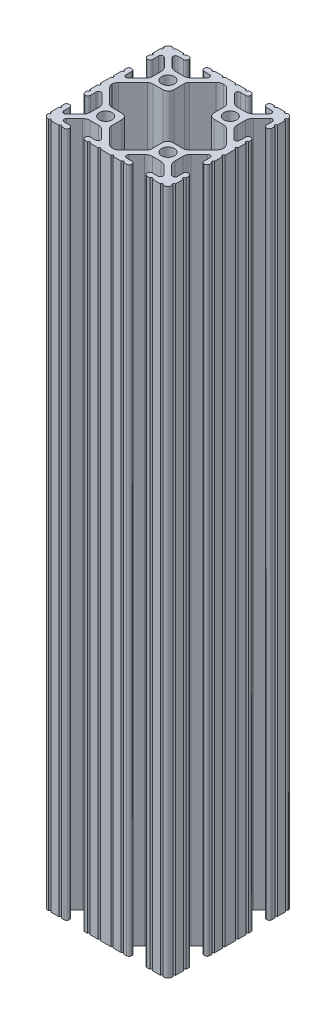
SolidWorks part; units mm, degrees
ref_plane "Front Plane" through (0, 0, 0) normal (0, 0, 1) x (1, 0, 0)
ref_plane "Top Plane" through (0, 0, 0) normal (0, 1, 0) x (1, 0, 0)
ref_plane "Right Plane" through (0, 0, 0) normal (1, 0, 0) x (0, 0, -1)
sketch "Sketch1" plane through (0, 0, 0) normal (0, 1, 0) x (0, 0, -1)
  line L0 (-7.684, -16.0797) -> (-1.9878, -21.7759)
  line L1 (-8.3312, -10.3886) -> (-8.3312, -14.5171)
  line L2 (-14.8165, -8.1788) -> (-10.541, -8.1788)
  line L3 (-21.7734, -2.1502) -> (-16.3772, -7.5334)
  line L4 (-22.6314, 0.0822) -> (-22.6314, -0.0822)
  line L5 (-16.3772, 7.5334) -> (-21.7734, 2.1502)
  line L6 (-10.541, 8.1788) -> (-14.8165, 8.1788)
  line L7 (-8.3312, 14.5171) -> (-8.3312, 10.3886)
  line L8 (-1.7956, 21.9681) -> (-7.684, 16.0797)
  line L9 (7.684, 16.0797) -> (1.7956, 21.9681)
  line L10 (8.3312, 10.389) -> (8.3312, 14.5171)
  line L11 (14.8161, 8.1792) -> (10.541, 8.1792)
  line L12 (21.7734, 2.1502) -> (16.3768, 7.5339)
  line L13 (22.6314, -0.0822) -> (22.6314, 0.0822)
  line L14 (16.3772, -7.5334) -> (21.7734, -2.1502)
  line L15 (10.541, -8.1788) -> (14.8165, -8.1788)
  line L16 (8.3312, -14.5171) -> (8.3312, -10.3886)
  line L17 (1.9878, -21.7759) -> (7.684, -16.0797)
  line L18 (7.4579, -25.3998) -> (8.4051, -25.3998)
  line L19 (9.4615, -24.3585) -> (9.4615, -24.2315)
  line L20 (8.4051, -23.1902) -> (6.0878, -23.1902)
  line L21 (5.388, -21.5008) -> (8.763, -18.1257)
  line L22 (11.0081, -17.1958) -> (14.3919, -17.1958)
  line L23 (16.637, -18.1257) -> (20.012, -21.5008)
  line L24 (19.2977, -23.1901) -> (16.9799, -23.1901)
  line L25 (15.9385, -24.2315) -> (15.9385, -24.3585)
  line L26 (16.9949, -25.3998) -> (18.134, -25.3998)
  line L27 (19.1384, -25.3998) -> (22.4132, -25.3998)
  line L28 (23.4176, -25.3998) -> (23.4501, -25.3998)
  line L29 (25.4, -23.2975) -> (25.4, -23.2686)
  line L30 (25.4, -22.2526) -> (25.4, -19.0252)
  line L31 (25.4, -18.0092) -> (25.4, -16.916)
  line L32 (24.3586, -15.8746) -> (24.2316, -15.8746)
  line L33 (23.1902, -16.916) -> (23.1902, -19.101)
  line L34 (21.4558, -19.8194) -> (18.2781, -16.6418)
  line L35 (17.3482, -14.3967) -> (17.3482, -11.0035)
  line L36 (18.2808, -8.7557) -> (21.4566, -5.5875)
  line L37 (23.1902, -6.3068) -> (23.1902, -8.484)
  line L38 (24.2316, -9.5254) -> (24.3586, -9.5254)
  line L39 (25.4, -8.484) -> (25.4, -7.3277)
  line L40 (25.4, -6.3117) -> (25.4, -3.0843)
  line L41 (25.4, -2.0683) -> (25.4, 2.0683)
  line L42 (25.4, 3.0843) -> (25.4, 6.3117)
  line L43 (25.4, 7.3277) -> (25.4, 8.484)
  line L44 (24.3586, 9.5254) -> (24.2316, 9.5254)
  line L45 (23.1902, 8.484) -> (23.1902, 6.3068)
  line L46 (21.4566, 5.5875) -> (18.2808, 8.7557)
  line L47 (17.3482, 11.0035) -> (17.3482, 14.3967)
  line L48 (18.2781, 16.6418) -> (21.4558, 19.8194)
  line L49 (23.1902, 19.101) -> (23.1902, 16.916)
  line L50 (24.2316, 15.8746) -> (24.3586, 15.8746)
  line L51 (25.4, 16.916) -> (25.4, 18.0092)
  line L52 (25.4, 19.0252) -> (25.4, 22.2526)
  line L53 (25.4, 23.2686) -> (25.4, 23.2975)
  line L54 (23.4501, 25.3998) -> (23.4176, 25.3998)
  line L55 (22.4132, 25.3998) -> (19.1384, 25.3998)
  line L56 (18.134, 25.3998) -> (16.9949, 25.3998)
  line L57 (15.9385, 24.3585) -> (15.9385, 24.2315)
  line L58 (16.9799, 23.1901) -> (19.2977, 23.1901)
  line L59 (20.012, 21.5008) -> (16.637, 18.1257)
  line L60 (14.3919, 17.1958) -> (11.0081, 17.1958)
  line L61 (8.763, 18.1257) -> (5.388, 21.5008)
  line L62 (6.0878, 23.1902) -> (8.4051, 23.1902)
  line L63 (9.4615, 24.2315) -> (9.4615, 24.3585)
  line L64 (8.4051, 25.3998) -> (7.4579, 25.3998)
  line L65 (6.4535, 25.3998) -> (3.2145, 25.3998)
  line L66 (2.2101, 25.3998) -> (-2.2101, 25.3998)
  line L67 (-3.2145, 25.3998) -> (-6.4535, 25.3998)
  line L68 (-7.4579, 25.3998) -> (-8.4051, 25.3998)
  line L69 (-9.4615, 24.3585) -> (-9.4615, 24.2315)
  line L70 (-8.4051, 23.1902) -> (-6.0878, 23.1902)
  line L71 (-5.388, 21.5008) -> (-8.763, 18.1257)
  line L72 (-11.0081, 17.1958) -> (-14.3919, 17.1958)
  line L73 (-16.637, 18.1257) -> (-20.012, 21.5008)
  line L74 (-19.2977, 23.1901) -> (-16.9799, 23.1901)
  line L75 (-15.9385, 24.2315) -> (-15.9385, 24.3585)
  line L76 (-16.9949, 25.3998) -> (-18.134, 25.3998)
  line L77 (-19.1384, 25.3998) -> (-22.4132, 25.3998)
  line L78 (-23.4176, 25.3998) -> (-23.4501, 25.3998)
  line L79 (-25.4, 23.2975) -> (-25.4, 23.2686)
  line L80 (-25.4, 22.2526) -> (-25.4, 19.0252)
  line L81 (-25.4, 18.0092) -> (-25.4, 16.916)
  line L82 (-24.3586, 15.8746) -> (-24.2316, 15.8746)
  line L83 (-23.1902, 16.916) -> (-23.1902, 19.101)
  line L84 (-21.4558, 19.8194) -> (-18.2781, 16.6418)
  line L85 (-17.3482, 14.3967) -> (-17.3482, 11.0035)
  line L86 (-18.2808, 8.7557) -> (-21.4566, 5.5875)
  line L87 (-23.1902, 6.3068) -> (-23.1902, 8.484)
  line L88 (-24.2316, 9.5254) -> (-24.3586, 9.5254)
  line L89 (-25.4, 8.484) -> (-25.4, 7.3277)
  line L90 (-25.4, 6.3117) -> (-25.4, 3.0843)
  line L91 (-25.4, 2.0683) -> (-25.4, -2.0683)
  line L92 (-25.4, -3.0843) -> (-25.4, -6.3117)
  line L93 (-25.4, -7.3277) -> (-25.4, -8.484)
  line L94 (-24.3586, -9.5254) -> (-24.2316, -9.5254)
  line L95 (-23.1902, -8.484) -> (-23.1902, -6.3068)
  line L96 (-21.4566, -5.5875) -> (-18.2808, -8.7557)
  line L97 (-17.3482, -11.0035) -> (-17.3482, -14.3967)
  line L98 (-18.2781, -16.6418) -> (-21.4558, -19.8194)
  line L99 (-23.1902, -19.101) -> (-23.1902, -16.916)
  line L100 (-24.2316, -15.8746) -> (-24.3586, -15.8746)
  line L101 (-25.4, -16.916) -> (-25.4, -18.0092)
  line L102 (-25.4, -19.0252) -> (-25.4, -22.2526)
  line L103 (-25.4, -23.2686) -> (-25.4, -23.2975)
  line L104 (-23.4501, -25.3998) -> (-23.4176, -25.3998)
  line L105 (-22.4132, -25.3998) -> (-19.1384, -25.3998)
  line L106 (-18.134, -25.3998) -> (-16.9949, -25.3998)
  line L107 (-15.9385, -24.3585) -> (-15.9385, -24.2315)
  line L108 (-16.9799, -23.1901) -> (-19.2977, -23.1901)
  line L109 (-20.012, -21.5008) -> (-16.637, -18.1257)
  line L110 (-14.3919, -17.1958) -> (-11.0081, -17.1958)
  line L111 (-8.763, -18.1257) -> (-5.388, -21.5008)
  line L112 (-6.0878, -23.1902) -> (-8.4051, -23.1902)
  line L113 (-9.4615, -24.2315) -> (-9.4615, -24.3585)
  line L114 (-8.4051, -25.3998) -> (-7.4579, -25.3998)
  line L115 (-6.4535, -25.3998) -> (-3.2145, -25.3998)
  line L116 (-2.2101, -25.3998) -> (2.2101, -25.3998)
  line L117 (3.2145, -25.3998) -> (6.4535, -25.3998)
  circle A0 centre (12.7, 12.7) radius 2.6035
  circle A1 centre (-12.7, 12.7) radius 2.6035
  circle A2 centre (-12.7, -12.7) radius 2.6035
  arc A3 (0, -22.6304) -> (1.9878, -21.7759) centre (-0.0777, -19.7104) ccw
  arc A4 (-1.9878, -21.7759) -> (0, -22.6304) centre (0.0777, -19.7104) ccw
  arc A5 (-8.3312, -14.5171) -> (-7.684, -16.0797) centre (-6.1214, -14.5171) ccw
  arc A6 (-8.3312, -10.3886) -> (-10.541, -8.1788) centre (-10.541, -10.3886) ccw
  arc A7 (-16.3772, -7.5334) -> (-14.8165, -8.1788) centre (-14.8165, -5.969) ccw
  arc A8 (-22.6314, -0.0822) -> (-21.7734, -2.1502) centre (-19.7104, -0.0822) ccw
  arc A9 (-21.7734, 2.1502) -> (-22.6314, 0.0822) centre (-19.7104, 0.0822) ccw
  arc A10 (-14.8165, 8.1788) -> (-16.3772, 7.5334) centre (-14.8165, 5.969) ccw
  arc A11 (-10.541, 8.1788) -> (-8.3312, 10.3886) centre (-10.541, 10.3886) ccw
  arc A12 (-7.684, 16.0797) -> (-8.3312, 14.5171) centre (-6.1214, 14.5171) ccw
  arc A13 (0, 22.8111) -> (-1.7956, 21.9681) centre (0.2699, 19.9026) ccw
  arc A14 (1.7956, 21.9681) -> (0, 22.8111) centre (-0.2699, 19.9026) ccw
  arc A15 (8.3312, 14.5171) -> (7.684, 16.0797) centre (6.1214, 14.5171) ccw
  arc A16 (8.3312, 10.389) -> (10.541, 8.1792) centre (10.541, 10.389) ccw
  arc A17 (16.3768, 7.5339) -> (14.8161, 8.1792) centre (14.8161, 5.9694) ccw
  arc A18 (22.6314, 0.0822) -> (21.7734, 2.1502) centre (19.7104, 0.0822) ccw
  arc A19 (21.7734, -2.1502) -> (22.6314, -0.0822) centre (19.7104, -0.0822) ccw
  arc A20 (14.8165, -8.1788) -> (16.3772, -7.5334) centre (14.8165, -5.969) ccw
  arc A21 (10.541, -8.1788) -> (8.3312, -10.3886) centre (10.541, -10.3886) ccw
  arc A22 (7.684, -16.0797) -> (8.3312, -14.5171) centre (6.1214, -14.5171) ccw
  circle A23 centre (12.7, -12.7) radius 2.6035
  arc A24 (7.4579, -25.3998) -> (6.4535, -25.3998) centre (6.9557, -25.3232) ccw
  arc A25 (8.4051, -25.3998) -> (9.4615, -24.3585) centre (8.4201, -24.3585) ccw
  arc A26 (9.4615, -24.2315) -> (8.4051, -23.1902) centre (8.4201, -24.2315) ccw
  arc A27 (5.388, -21.5008) -> (6.0878, -23.1902) centre (6.0878, -22.2006) ccw
  arc A28 (11.0081, -17.1958) -> (8.763, -18.1257) centre (11.0081, -20.3708) ccw
  arc A29 (16.637, -18.1257) -> (14.3919, -17.1958) centre (14.3919, -20.3708) ccw
  arc A30 (19.2977, -23.1901) -> (20.012, -21.5008) centre (19.3122, -22.2006) ccw
  arc A31 (16.9799, -23.1901) -> (15.9385, -24.2315) centre (16.9799, -24.2315) ccw
  arc A32 (15.9385, -24.3585) -> (16.9949, -25.3998) centre (16.9799, -24.3585) ccw
  arc A33 (19.1384, -25.3998) -> (18.134, -25.3998) centre (18.6362, -25.3232) ccw
  arc A34 (23.4176, -25.3998) -> (22.4132, -25.3998) centre (22.9154, -25.3232) ccw
  arc A35 (23.4501, -25.3998) -> (25.4, -23.2975) centre (23.2918, -23.2975) ccw
  arc A36 (25.4, -22.2526) -> (25.4, -23.2686) centre (25.4, -22.7606) ccw
  arc A37 (25.4, -18.0092) -> (25.4, -19.0252) centre (25.4, -18.5172) ccw
  arc A38 (25.4, -16.916) -> (24.3586, -15.8746) centre (24.3586, -16.916) ccw
  arc A39 (24.2316, -15.8746) -> (23.1902, -16.916) centre (24.2316, -16.916) ccw
  arc A40 (21.4558, -19.8194) -> (23.1902, -19.101) centre (22.1742, -19.101) ccw
  arc A41 (17.3482, -14.3967) -> (18.2781, -16.6418) centre (20.5232, -14.3967) ccw
  arc A42 (18.2808, -8.7557) -> (17.3482, -11.0035) centre (20.5232, -11.0035) ccw
  arc A43 (23.1902, -6.3068) -> (21.4566, -5.5875) centre (22.1742, -6.3068) ccw
  arc A44 (23.1902, -8.484) -> (24.2316, -9.5254) centre (24.2316, -8.484) ccw
  arc A45 (24.3586, -9.5254) -> (25.4, -8.484) centre (24.3586, -8.484) ccw
  arc A46 (25.4, -6.3117) -> (25.4, -7.3277) centre (25.4, -6.8197) ccw
  arc A47 (25.4, -2.0683) -> (25.4, -3.0843) centre (25.4, -2.5763) ccw
  arc A48 (25.4, 3.0843) -> (25.4, 2.0683) centre (25.4, 2.5763) ccw
  arc A49 (25.4, 7.3277) -> (25.4, 6.3117) centre (25.4, 6.8197) ccw
  arc A50 (25.4, 8.484) -> (24.3586, 9.5254) centre (24.3586, 8.484) ccw
  arc A51 (24.2316, 9.5254) -> (23.1902, 8.484) centre (24.2316, 8.484) ccw
  arc A52 (21.4566, 5.5875) -> (23.1902, 6.3068) centre (22.1742, 6.3068) ccw
  arc A53 (17.3482, 11.0035) -> (18.2808, 8.7557) centre (20.5232, 11.0035) ccw
  arc A54 (18.2781, 16.6418) -> (17.3482, 14.3967) centre (20.5232, 14.3967) ccw
  arc A55 (23.1902, 19.101) -> (21.4558, 19.8194) centre (22.1742, 19.101) ccw
  arc A56 (23.1902, 16.916) -> (24.2316, 15.8746) centre (24.2316, 16.916) ccw
  arc A57 (24.3586, 15.8746) -> (25.4, 16.916) centre (24.3586, 16.916) ccw
  arc A58 (25.4, 19.0252) -> (25.4, 18.0092) centre (25.4, 18.5172) ccw
  arc A59 (25.4, 23.2686) -> (25.4, 22.2526) centre (25.4, 22.7606) ccw
  arc A60 (25.4, 23.2975) -> (23.4501, 25.3998) centre (23.2918, 23.2975) ccw
  arc A61 (22.4132, 25.3998) -> (23.4176, 25.3998) centre (22.9154, 25.3232) ccw
  arc A62 (18.134, 25.3998) -> (19.1384, 25.3998) centre (18.6362, 25.3232) ccw
  arc A63 (16.9949, 25.3998) -> (15.9385, 24.3585) centre (16.9799, 24.3585) ccw
  arc A64 (15.9385, 24.2315) -> (16.9799, 23.1901) centre (16.9799, 24.2315) ccw
  arc A65 (20.012, 21.5008) -> (19.2977, 23.1901) centre (19.3122, 22.2006) ccw
  arc A66 (14.3919, 17.1958) -> (16.637, 18.1257) centre (14.3919, 20.3708) ccw
  arc A67 (8.763, 18.1257) -> (11.0081, 17.1958) centre (11.0081, 20.3708) ccw
  arc A68 (6.0878, 23.1902) -> (5.388, 21.5008) centre (6.0878, 22.2006) ccw
  arc A69 (8.4051, 23.1902) -> (9.4615, 24.2315) centre (8.4201, 24.2315) ccw
  arc A70 (9.4615, 24.3585) -> (8.4051, 25.3998) centre (8.4201, 24.3585) ccw
  arc A71 (6.4535, 25.3998) -> (7.4579, 25.3998) centre (6.9557, 25.3232) ccw
  arc A72 (2.2101, 25.3998) -> (3.2145, 25.3998) centre (2.7123, 25.3232) ccw
  arc A73 (-3.2145, 25.3998) -> (-2.2101, 25.3998) centre (-2.7123, 25.3232) ccw
  arc A74 (-7.4579, 25.3998) -> (-6.4535, 25.3998) centre (-6.9557, 25.3232) ccw
  arc A75 (-8.4051, 25.3998) -> (-9.4615, 24.3585) centre (-8.4201, 24.3585) ccw
  arc A76 (-9.4615, 24.2315) -> (-8.4051, 23.1902) centre (-8.4201, 24.2315) ccw
  arc A77 (-5.388, 21.5008) -> (-6.0878, 23.1902) centre (-6.0878, 22.2006) ccw
  arc A78 (-11.0081, 17.1958) -> (-8.763, 18.1257) centre (-11.0081, 20.3708) ccw
  arc A79 (-16.637, 18.1257) -> (-14.3919, 17.1958) centre (-14.3919, 20.3708) ccw
  arc A80 (-19.2977, 23.1901) -> (-20.012, 21.5008) centre (-19.3122, 22.2006) ccw
  arc A81 (-16.9799, 23.1901) -> (-15.9385, 24.2315) centre (-16.9799, 24.2315) ccw
  arc A82 (-15.9385, 24.3585) -> (-16.9949, 25.3998) centre (-16.9799, 24.3585) ccw
  arc A83 (-19.1384, 25.3998) -> (-18.134, 25.3998) centre (-18.6362, 25.3232) ccw
  arc A84 (-23.4176, 25.3998) -> (-22.4132, 25.3998) centre (-22.9154, 25.3232) ccw
  arc A85 (-23.4501, 25.3998) -> (-25.4, 23.2975) centre (-23.2918, 23.2975) ccw
  arc A86 (-25.4, 22.2526) -> (-25.4, 23.2686) centre (-25.4, 22.7606) ccw
  arc A87 (-25.4, 18.0092) -> (-25.4, 19.0252) centre (-25.4, 18.5172) ccw
  arc A88 (-25.4, 16.916) -> (-24.3586, 15.8746) centre (-24.3586, 16.916) ccw
  arc A89 (-24.2316, 15.8746) -> (-23.1902, 16.916) centre (-24.2316, 16.916) ccw
  arc A90 (-21.4558, 19.8194) -> (-23.1902, 19.101) centre (-22.1742, 19.101) ccw
  arc A91 (-17.3482, 14.3967) -> (-18.2781, 16.6418) centre (-20.5232, 14.3967) ccw
  arc A92 (-18.2808, 8.7557) -> (-17.3482, 11.0035) centre (-20.5232, 11.0035) ccw
  arc A93 (-23.1902, 6.3068) -> (-21.4566, 5.5875) centre (-22.1742, 6.3068) ccw
  arc A94 (-23.1902, 8.484) -> (-24.2316, 9.5254) centre (-24.2316, 8.484) ccw
  arc A95 (-24.3586, 9.5254) -> (-25.4, 8.484) centre (-24.3586, 8.484) ccw
  arc A96 (-25.4, 6.3117) -> (-25.4, 7.3277) centre (-25.4, 6.8197) ccw
  arc A97 (-25.4, 2.0683) -> (-25.4, 3.0843) centre (-25.4, 2.5763) ccw
  arc A98 (-25.4, -3.0843) -> (-25.4, -2.0683) centre (-25.4, -2.5763) ccw
  arc A99 (-25.4, -7.3277) -> (-25.4, -6.3117) centre (-25.4, -6.8197) ccw
  arc A100 (-25.4, -8.484) -> (-24.3586, -9.5254) centre (-24.3586, -8.484) ccw
  arc A101 (-24.2316, -9.5254) -> (-23.1902, -8.484) centre (-24.2316, -8.484) ccw
  arc A102 (-21.4566, -5.5875) -> (-23.1902, -6.3068) centre (-22.1742, -6.3068) ccw
  arc A103 (-17.3482, -11.0035) -> (-18.2808, -8.7557) centre (-20.5232, -11.0035) ccw
  arc A104 (-18.2781, -16.6418) -> (-17.3482, -14.3967) centre (-20.5232, -14.3967) ccw
  arc A105 (-23.1902, -19.101) -> (-21.4558, -19.8194) centre (-22.1742, -19.101) ccw
  arc A106 (-23.1902, -16.916) -> (-24.2316, -15.8746) centre (-24.2316, -16.916) ccw
  arc A107 (-24.3586, -15.8746) -> (-25.4, -16.916) centre (-24.3586, -16.916) ccw
  arc A108 (-25.4, -19.0252) -> (-25.4, -18.0092) centre (-25.4, -18.5172) ccw
  arc A109 (-25.4, -23.2686) -> (-25.4, -22.2526) centre (-25.4, -22.7606) ccw
  arc A110 (-25.4, -23.2975) -> (-23.4501, -25.3998) centre (-23.2918, -23.2975) ccw
  arc A111 (-22.4132, -25.3998) -> (-23.4176, -25.3998) centre (-22.9154, -25.3232) ccw
  arc A112 (-18.134, -25.3998) -> (-19.1384, -25.3998) centre (-18.6362, -25.3232) ccw
  arc A113 (-16.9949, -25.3998) -> (-15.9385, -24.3585) centre (-16.9799, -24.3585) ccw
  arc A114 (-15.9385, -24.2315) -> (-16.9799, -23.1901) centre (-16.9799, -24.2315) ccw
  arc A115 (-20.012, -21.5008) -> (-19.2977, -23.1901) centre (-19.3122, -22.2006) ccw
  arc A116 (-14.3919, -17.1958) -> (-16.637, -18.1257) centre (-14.3919, -20.3708) ccw
  arc A117 (-8.763, -18.1257) -> (-11.0081, -17.1958) centre (-11.0081, -20.3708) ccw
  arc A118 (-6.0878, -23.1902) -> (-5.388, -21.5008) centre (-6.0878, -22.2006) ccw
  arc A119 (-8.4051, -23.1902) -> (-9.4615, -24.2315) centre (-8.4201, -24.2315) ccw
  arc A120 (-9.4615, -24.3585) -> (-8.4051, -25.3998) centre (-8.4201, -24.3585) ccw
  arc A121 (-6.4535, -25.3998) -> (-7.4579, -25.3998) centre (-6.9557, -25.3232) ccw
  arc A122 (-2.2101, -25.3998) -> (-3.2145, -25.3998) centre (-2.7123, -25.3232) ccw
  arc A123 (3.2145, -25.3998) -> (2.2101, -25.3998) centre (2.7123, -25.3232) ccw
extrude "Extrude1" add sketch "Sketch1" against normal mid plane 279.4
